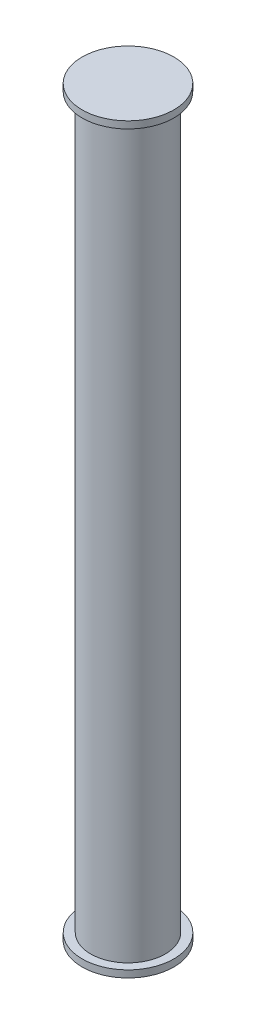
SolidWorks part; units mm, degrees
other "<RollerTube>-<Imported1>"
ref_plane "Front Plane" through (0, 0, 0) normal (0, 0, 1) x (1, 0, 0)
ref_plane "Top Plane" through (0, 0, 0) normal (0, 1, 0) x (1, 0, 0)
ref_plane "Right Plane" through (0, 0, 0) normal (1, 0, 0) x (0, 0, -1)
mirrored part "RollerTube_Mirrored"
